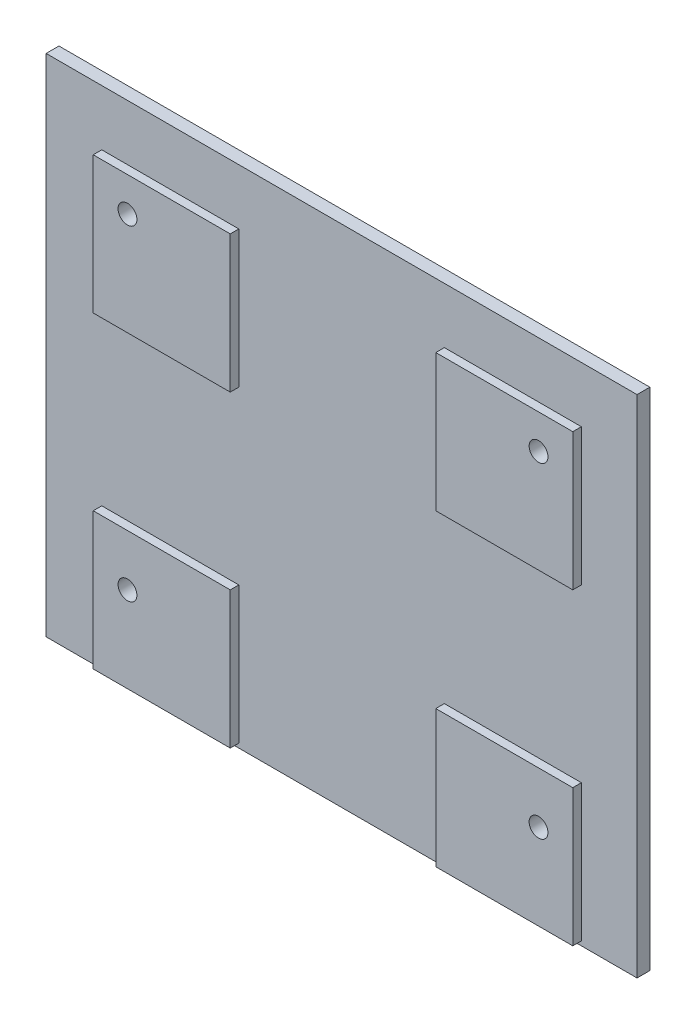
SolidWorks part; units mm, degrees
ref_plane "Plan de face" through (0, 0, 0) normal (0, 0, 1) x (1, 0, 0)
ref_plane "Plan de dessus" through (0, 0, 0) normal (0, 1, 0) x (1, 0, 0)
ref_plane "Plan de droite" through (0, 0, 0) normal (1, 0, 0) x (0, 0, -1)
sketch3d "Esquisse pour plaque robot" [suppressed]
  line L0 (315, -265, 0) -> (-315, -265, 0)
  line L1 (-315, 265, 0) -> (315, 265, 0)
  line L2 (315, 265, 0) -> (315, -265, 0)
  line L3 (-315, 265, 0) -> (315, -265, 0)
  line L4 (-315, -265, 0) -> (315, 265, 0)
  line L8 (-315, -265, 0) -> (-315, 265, 0)
  line L9 (315, -265, -50) -> (-315, -265, -50) construction
  line L10 (-315, 265, -50) -> (-315, -265, -50) construction
sketch "Esquisse2" plane through (0, 0, 0) normal (0, 0, 1) x (1, 0, 0)
  line L0 (345, -295) -> (-345, -295)
  line L1 (-345, -295) -> (-345, 295)
  line L2 (-345, 295) -> (345, 295)
  line L3 (345, 295) -> (345, -295)
  line L4 (-355, 305) -> (355, 305) construction
  line L5 (355, 305) -> (355, -305) construction
  line L6 (355, -305) -> (-355, -305) construction
  dimension "D1" = 10
  dimension "D2" = 10
  dimension "D3" = 10
extrude "Plaque Robot" add sketch "Esquisse2" along normal blind 15
sketch "Esquisse8" plane through (0, 0, 15) normal (0, 0, 1) x (1, 0, 0)
  line L1 (-280, -290) -> (-120, -290)
  line L2 (-280, -290) -> (-280, -130)
  line L3 (-280, -130) -> (-120, -130)
  line L4 (-120, -290) -> (-120, -130)
  line L5 (120, -290) -> (280, -290)
  line L6 (120, -290) -> (120, -130)
  line L7 (120, -130) -> (280, -130)
  line L8 (280, -290) -> (280, -130)
  line L9 (120, 70) -> (280, 70)
  line L10 (120, 70) -> (120, 230)
  line L11 (120, 230) -> (280, 230)
  line L12 (280, 70) -> (280, 230)
  line L13 (-280, 70) -> (-120, 70)
  line L14 (-280, 70) -> (-280, 230)
  line L15 (-280, 230) -> (-120, 230)
  line L16 (-120, 70) -> (-120, 230)
  dimension "D1" = 160
  dimension "D2" = 160
  dimension "D3" = 160
  dimension "D4" = 160
extrude "Extrusion1" add sketch "Esquisse8" along normal blind 10
ref_plane "Plan percage" through (0, 0, 25) normal (0, 0, 1) x (1, 0, 0)
sketch "Esquisse6" plane through (0, 0, 25) normal (0, 0, 1) x (1, 0, 0)
  line L0 (-240, -190) -> (240, 190)
  line L1 (-240, -190) -> (240, -190)
  line L2 (-240, -190) -> (-240, 190)
  line L3 (-240, 190) -> (240, 190)
  line L4 (240, -190) -> (240, 190)
  line L5 (-240, 190) -> (240, -190)
  dimension "D1" = 380
  dimension "D2" = 480
hole_wizard "Trou taraudé M241" positions "Esquisse3D4" profile "Esquisse7" tap size "M24" standard "ISO"
sketch3d "Esquisse3D4"
  line L0 (-240, -190, 26) -> (240, 190, 26) construction
  point P0 (-240, -190, 26)
  point P3 (240, -190, 26)
  point P6 (240, 190, 26)
  point P10 (-240, 190, 26)
sketch "Esquisse7" plane through (-240, -190, 26) normal (1, 0, 0) x (0, -1, 0)
  line L0 (0, 0) -> (0, 63.309)
  line L1 (0, 63.309) -> (10.5, 57)
  line L2 (10.5, 57) -> (10.5, 0)
  line L5 (10.5, 0) -> (0, 0)
  line L10 (0, 63.309) -> (-10.5, 57) construction
  line L11 (0, -6.35) -> (0, 107.95) construction
  dimension "Diamètre du trou pour taraudage" = 21
  dimension "Profondeur du trou pour taraudage" = 57
  dimension "Angle de pointe" = 118
sketch "Esquisse9" plane through (0, 0, 25) normal (0, 0, 1) x (1, 0, 0)
  circle A0 centre (-240, 190) radius 11
  circle A1 centre (240, 190) radius 11
  circle A2 centre (240, -190) radius 11
  circle A3 centre (-240, -190) radius 11
  dimension "D1" = 22
  dimension "D2" = 22
  dimension "D3" = 22
  dimension "D4" = 22
extrude "Extrusion2" cut sketch "Esquisse9" against normal up to next
